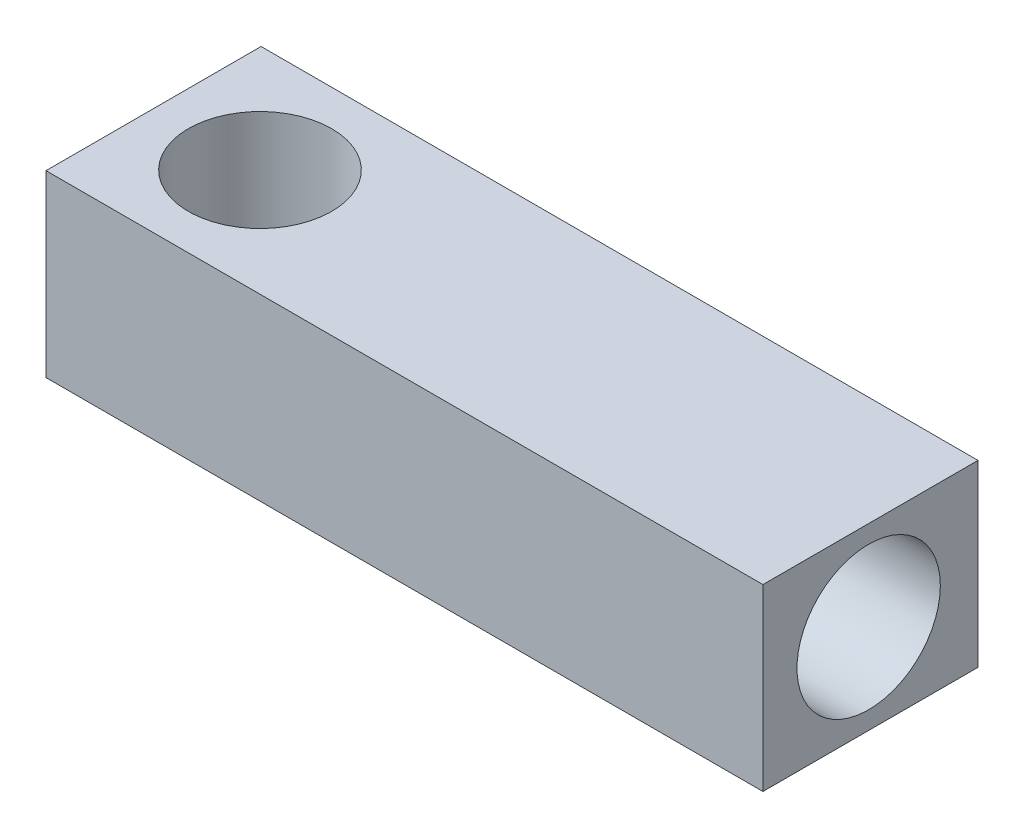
SolidWorks part; units mm, degrees
ref_plane "Front Plane" through (0, 0, 0) normal (0, 0, 1) x (1, 0, 0)
ref_plane "Top Plane" through (0, 0, 0) normal (0, 1, 0) x (1, 0, 0)
ref_plane "Right Plane" through (0, 0, 0) normal (1, 0, 0) x (0, 0, -1)
sketch "Sketch1" plane through (0, 0, 0) normal (0, 0, 1) x (1, 0, 0)
  line L1 (-60.7936, 9.2304) -> (39.2064, 9.2304)
  line L2 (-60.7936, 9.2304) -> (-60.7936, -15.7696)
  line L3 (-60.7936, -15.7696) -> (39.2064, -15.7696)
  line L4 (39.2064, 9.2304) -> (39.2064, -15.7696)
  dimension "D1" = 25
  dimension "D2" = 100
extrude "Boss-Extrude2" add sketch "Sketch1" along normal blind 30
sketch "Sketch4" plane through (39.2064, 0, 0) normal (1, 0, 0) x (0, 0, -1)
  line L0 (-30, 9.2304) -> (0, 9.2304) construction
  circle A0 centre (-15.2518, -3.2696) radius 10
  point P6 (-77.7024, 6.9525)
  dimension "D2" = 20
  dimension "D1" = 12.5
extrude "Cut-Extrude1" cut sketch "Sketch4" against normal blind 55
sketch "Sketch5" plane through (0, -15.7696, 0) normal (0, -1, 0) x (1, 0, 0)
  line L5 (39.2064, 0) -> (-60.7936, 0) construction
  circle A0 centre (-45.9431, 15) radius 10
  dimension "D2" = 20
  dimension "D1" = 15
extrude "Cut-Extrude2" cut sketch "Sketch5" against normal blind 55
